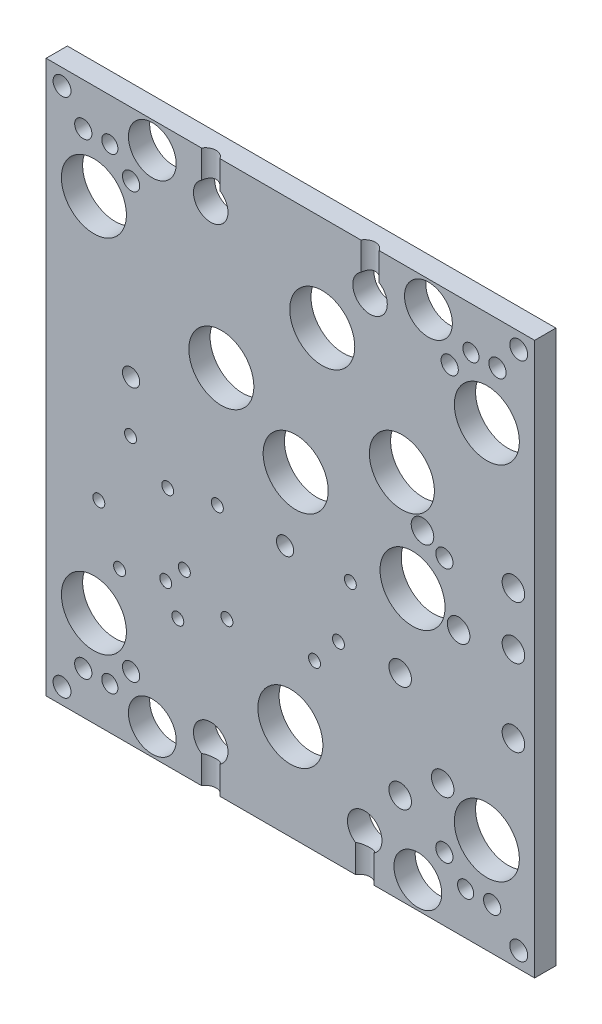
SolidWorks part; units mm, degrees
ref_plane "Front" through (0, 0, 0) normal (0, 0, 1) x (1, 0, 0)
ref_plane "Top" through (0, 0, 0) normal (0, 1, 0) x (1, 0, 0)
ref_plane "Right" through (0, 0, 0) normal (1, 0, 0) x (0, 0, -1)
sketch "Sketch1" plane through (0, 0, 0) normal (0, 0, 1) x (1, 0, 0)
  line L4 (-744.22, -180.975) -> (-452.12, -180.975)
  line L5 (-744.22, 149.225) -> (-744.22, -180.975)
  line L6 (-452.12, 149.225) -> (-744.22, 149.225)
  line L7 (-452.12, -180.975) -> (-452.12, 149.225)
  line L8 (-744.22, -180.975) -> (-452.12, -180.975)
  line L9 (-744.22, 149.225) -> (-744.22, -180.975)
  line L10 (-452.12, 149.225) -> (-744.22, 149.225)
  line L11 (-452.12, -180.975) -> (-452.12, 149.225)
  dimension "D1" = 0
extrude "Boss-Extrude1" add sketch "Sketch1" along normal blind 12.7 separate body
hole_wizard "Hole12" positions "Point_Sketch2" profile "Profil_Sketch2" hole size "Ø0.15" standard "ISO"
sketch "Point_Sketch2" plane through (-580.0679, -71.9155, 0) normal (0, 0, 1) x (-1, 0, 0)
  point P0 (3.6706, 10.6011)
  point P2 (-17.7441, -40.9069)
  point P4 (-10.6154, -6.4242)
sketch "Profil_Sketch2" plane through (-583.7385, -82.5166, 0) normal (1, 0, 0) x (0, 1, 0)
  line L0 (0, 0) -> (0, 12.7)
  line L1 (0, 12.7) -> (3.5687, 12.7)
  line L2 (3.5687, 12.7) -> (3.5687, 0)
  line L5 (3.5687, 0) -> (0, 0)
  line L11 (0, -6.35) -> (0, 107.95) construction
  dimension "Diameter" = 7.1374
  dimension "Thru Hole Depth" = 12.7
other "usin_DL090_.25-20x3-SHCS<2>"
hole_wizard "Hole13" positions "Point_Sketch3" profile "Profil_Sketch3" hole size "Ø0.15" standard "ISO"
sketch "Point_Sketch3" plane through (-638.1715, -20.035, 0) normal (0, 0, 1) x (-1, 0, 0)
  point P0 (3.6543, 10.9736)
  point P2 (23.3871, 54.2492)
sketch "Profil_Sketch3" plane through (-641.8258, -31.0086, 0) normal (1, 0, 0) x (0, 1, 0)
  line L0 (0, 0) -> (0, 12.7)
  line L1 (0, 12.7) -> (3.5687, 12.7)
  line L2 (3.5687, 12.7) -> (3.5687, 0)
  line L5 (3.5687, 0) -> (0, 0)
  line L11 (0, -6.35) -> (0, 107.95) construction
  dimension "Diameter" = 7.1374
  dimension "Thru Hole Depth" = 12.7
other "usin_DL090_.25-20x3-SHCS<3>"
hole_wizard "Hole14" positions "Point_Sketch4" profile "Profil_Sketch4" hole size "Ø0.15" standard "ISO"
sketch "Point_Sketch4" plane through (-669.0327, -75.0446, 0) normal (0, 0, 1) x (-1, 0, 0)
  point P0 (3.6543, 10.6011)
  point P2 (31.2649, 18.1837)
sketch "Profil_Sketch4" plane through (-672.6869, -85.6458, 0) normal (1, 0, 0) x (0, 1, 0)
  line L0 (0, 0) -> (0, 12.7)
  line L1 (0, 12.7) -> (3.5687, 12.7)
  line L2 (3.5687, 12.7) -> (3.5687, 0)
  line L5 (3.5687, 0) -> (0, 0)
  line L11 (0, -6.35) -> (0, 107.95) construction
  dimension "Diameter" = 7.1374
  dimension "Thru Hole Depth" = 12.7
other "usin_DL090_.25-20x3-SHCS<4>"
hole_wizard "Hole15" positions "Point_Sketch5" profile "Profil_Sketch5" hole size "Ø0.15" standard "ISO"
sketch "Point_Sketch5" plane through (-661.8264, -90.9577, 0) normal (0, 0, 1) x (-1, 0, 0)
  point P0 (3.6543, 10.6011)
  point P2 (-25.7119, -3.8452)
sketch "Profil_Sketch5" plane through (-665.4806, -101.5588, 0) normal (1, 0, 0) x (0, 1, 0)
  line L0 (0, 0) -> (0, 12.7)
  line L1 (0, 12.7) -> (3.5687, 12.7)
  line L2 (3.5687, 12.7) -> (3.5687, 0)
  line L5 (3.5687, 0) -> (0, 0)
  line L11 (0, -6.35) -> (0, 107.95) construction
  dimension "Diameter" = 7.1374
  dimension "Thru Hole Depth" = 12.7
other "usin_DL090_.25-20x3-SHCS<5>"
hole_wizard "Hole16" positions "Point_Sketch6" profile "Profil_Sketch6" hole size "Ø0.15" standard "ISO"
sketch "Point_Sketch6" plane through (-690.0832, -10.5362, 0) normal (0, 0, 1) x (-1, 0, 0)
  point P0 (3.6543, 10.6011)
  point P2 (22.6293, 53.408)
  point P4 (-18.5707, 26.4761)
sketch "Profil_Sketch6" plane through (-693.7375, -21.1374, 0) normal (1, 0, 0) x (0, 1, 0)
  line L0 (0, 0) -> (0, 12.7)
  line L1 (0, 12.7) -> (3.5687, 12.7)
  line L2 (3.5687, 12.7) -> (3.5687, 0)
  line L5 (3.5687, 0) -> (0, 0)
  line L11 (0, -6.35) -> (0, 107.95) construction
  dimension "Diameter" = 7.1374
  dimension "Thru Hole Depth" = 12.7
other "usin_DL090_.25-20x3-SHCS<6>"
hole_wizard "Hole17" positions "Point_Sketch7" profile "Profil_Sketch7" hole size "Ø0.15" standard "ISO"
sketch "Point_Sketch7" plane through (-527.9539, -6.8972, 12.7) normal (0, 0, -1) x (1, 0, 0)
  point P0 (47.2589, -98.9722)
  point P6 (-187.6911, -98.9722)
  point P8 (-187.6911, 116.9278)
  point P10 (-111.4911, -48.1722)
  point P12 (-3.5411, -48.1722)
  point P16 (-70.2161, 116.9278)
  point P18 (-67.0411, -16.4222)
  point P20 (-51.1661, -98.9722)
sketch "Profil_Sketch7" plane through (-480.695, 92.075, 12.7) normal (1, 0, 0) x (0, -1, 0)
  line L0 (0, 0) -> (0, 12.7)
  line L1 (0, 12.7) -> (19.4437, 12.7)
  line L2 (19.4437, 12.7) -> (19.4437, 0)
  line L5 (19.4437, 0) -> (0, 0)
  line L11 (0, -6.35) -> (0, 107.95) construction
  dimension "Diameter" = 38.8874
  dimension "Thru Hole Depth" = 12.7
other "usin_DL090_DADCO INCH U 0600.025 - 1500 psi<7>"
hole_wizard "Hole18" positions "Point_Sketch8" profile "Profil_Sketch8" hole size "Ø0.15" standard "ISO"
sketch "Point_Sketch8" plane through (-505.6157, -154.4989, 0) normal (0, 0, 1) x (-1, 0, 0)
  point P0 (16.3543, 10.6011)
  point P2 (10.0043, -287.8489)
  point P4 (175.1043, -287.8489)
  point P6 (175.1043, 10.6011)
sketch "Profil_Sketch8" plane through (-521.97, -165.1, 0) normal (1, 0, 0) x (0, 1, 0)
  line L0 (0, 0) -> (0, 12.7)
  line L1 (0, 12.7) -> (14.2875, 12.7)
  line L2 (14.2875, 12.7) -> (14.2875, 0)
  line L5 (14.2875, 0) -> (0, 0)
  line L11 (0, -6.35) -> (0, 107.95) construction
  dimension "Diameter" = 28.575
  dimension "Thru Hole Depth" = 12.7
other "usin_DL090<8>"
hole_wizard "Hole19" positions "Point_Sketch9" profile "Profil_Sketch9" hole size "Ø0.15" standard "ISO"
sketch "Point_Sketch9" plane through (-718.3407, 134.4261, 0) normal (0, 0, 1) x (-1, 0, 0)
  point P0 (3.6543, 10.6011)
  point P2 (-243.9957, 10.6011)
  point P4 (-240.8207, 290.0011)
  point P6 (3.6543, 290.0011)
  point P8 (-116.9957, 166.1761)
  point P10 (-212.2457, 124.9011)
  point P12 (-24.9207, 124.9011)
sketch "Profil_Sketch9" plane through (-721.995, 123.825, 0) normal (1, 0, 0) x (0, 1, 0)
  line L0 (0, 0) -> (0, 12.7)
  line L1 (0, 12.7) -> (5.1562, 12.7)
  line L2 (5.1562, 12.7) -> (5.1562, 0)
  line L5 (5.1562, 0) -> (0, 0)
  line L11 (0, -6.35) -> (0, 107.95) construction
  dimension "Diameter" = 10.3124
  dimension "Thru Hole Depth" = 12.7
other "usin_DL090_.375-16x2-SHCS<9>"
hole_wizard "Hole110" positions "Point_Sketch10" profile "Profil_Sketch10" hole size "Ø0.15" standard "ISO"
sketch "Point_Sketch10" plane through (-500.2243, -144.9739, 12.7) normal (0, 0, -1) x (1, 0, 0)
  point P0 (6.8293, 10.6011)
  point P2 (-205.8957, 10.6011)
  point P4 (-205.8957, -268.7989)
  point P6 (10.0043, -268.7989)
sketch "Profil_Sketch10" plane through (-493.395, -155.575, 12.7) normal (1, 0, 0) x (0, -1, 0)
  line L0 (0, 0) -> (0, 12.7)
  line L1 (0, 12.7) -> (4.826, 12.7)
  line L2 (4.826, 12.7) -> (4.826, 0)
  line L5 (4.826, 0) -> (0, 0)
  line L11 (0, -6.35) -> (0, 107.95) construction
  dimension "Diameter" = 9.652
  dimension "Thru Hole Depth" = 12.7
other "usin_DL090_.375 x 2.00 DOWEL PIN<10>"
hole_wizard "Hole111" positions "Point_Sketch11" profile "Profil_Sketch11" counterbore size "1/4" standard "ANSI Inch"
sketch "Point_Sketch11" plane through (-747.5641, 140.635, 12.7) normal (0, 0, -1) x (1, 0, 0)
  point P0 (12.8691, 0.935)
  point P2 (285.9191, 0.935)
  point P4 (285.9191, 312.085)
  point P6 (12.8691, 312.085)
sketch "Profil_Sketch11" plane through (-734.695, 139.7, 12.7) normal (1, 0, 0) x (0, -1, 0)
  line L0 (0, 0) -> (0, 12.7)
  line L1 (0, 12.7) -> (3.5687, 12.7)
  line L3 (3.5687, 12.7) -> (3.5687, 7.874)
  line L4 (3.5687, 7.874) -> (5.3594, 7.874)
  line L5 (5.3594, 7.874) -> (5.3594, 0)
  line L7 (5.3594, 0) -> (0, 0)
  line L11 (0, -6.35) -> (0, 107.95) construction
  dimension "Diameter" = 7.1374
  dimension "Thru Hole Depth" = 12.7
  dimension "L1" = 7.874
other "usin_LS160_.25-20x.625-SHCS<1>"
hole_wizard "Hole112" positions "Point_Sketch12" profile "Profil_Sketch12" hole size "Ø0.15" standard "ISO"
sketch "Point_Sketch12" plane through (-655.7993, 134.4261, 12.7) normal (0, 0, -1) x (1, 0, 0)
  point P0 (10.0043, 10.6011)
  point P2 (105.2543, 10.6011)
  point P4 (102.0793, 290.0011)
  point P6 (10.0043, 290.0011)
sketch "Profil_Sketch12" plane through (-645.795, 123.825, 12.7) normal (1, 0, 0) x (0, -1, 0)
  line L0 (0, 0) -> (0, 12.7)
  line L1 (0, 12.7) -> (10.3187, 12.7)
  line L2 (10.3187, 12.7) -> (10.3187, 0)
  line L5 (10.3187, 0) -> (0, 0)
  line L11 (0, -6.35) -> (0, 107.95) construction
  dimension "Diameter" = 20.6375
  dimension "Thru Hole Depth" = 12.7
other "usin_DL090<11>"
hole_wizard "Hole113" positions "Point_Sketch13" profile "Profil_Sketch13" hole size "Ø0.15" standard "ISO"
sketch "Point_Sketch13" plane through (-689.7657, -132.2739, 0) normal (0, 0, 1) x (-1, 0, 0)
  point P0 (3.6543, 10.6011)
  point P2 (-183.6707, 10.6011)
  point P4 (-186.8457, -243.3989)
  point P6 (3.6543, -243.3989)
sketch "Profil_Sketch13" plane through (-693.42, -142.875, 0) normal (1, 0, 0) x (0, 1, 0)
  line L0 (0, 0) -> (0, 12.7)
  line L1 (0, 12.7) -> (5.1594, 12.7)
  line L2 (5.1594, 12.7) -> (5.1594, 0)
  line L5 (5.1594, 0) -> (0, 0)
  line L11 (0, -6.35) -> (0, 107.95) construction
  dimension "Diameter" = 10.3187
  dimension "Thru Hole Depth" = 12.7
other "usin_DL090<12>"
sketch "Sketch4" plane through (0, -180.975, 0) normal (0, -1, 0) x (1, 0, 0)
  line L4 (-744.22, 12.7) -> (-452.12, 12.7) construction
  line L5 (-645.795, 0) -> (-645.795, 12.7) construction
  line L6 (-553.72, 0) -> (-553.72, 12.7) construction
  circle A0 centre (-645.795, 15.875) radius 6.35
  circle A1 centre (-553.72, 15.875) radius 6.35
  dimension "D1" = 12.7
  dimension "d2" = 3.175
extrude "Cut-Extrude1" cut sketch "Sketch4" against normal up to next
sketch "Sketch5" plane through (0, 149.225, 0) normal (0, 1, 0) x (1, 0, 0)
  line L0 (-452.12, -12.7) -> (-744.22, -12.7) construction
  line L1 (-550.545, 0) -> (-550.545, -12.7) construction
  line L2 (-645.795, 0) -> (-645.795, -12.7) construction
  circle A0 centre (-550.545, -15.875) radius 6.35
  circle A1 centre (-645.795, -15.875) radius 6.35
  dimension "D2" = 12.7
  dimension "D1" = 3.175
extrude "Cut-Extrude2" cut sketch "Sketch5" against normal up to next
hole_wizard "Hole1" positions "Point_Sketch" profile "Profil_Sketch" hole size "Ø0.15" standard "ISO"
sketch "Point_Sketch" plane through (-528.7993, -5.2739, 12.7) normal (0, 0, -1) x (1, 0, 0)
  point P0 (3.6543, 10.6011)
  point P2 (48.1043, 118.5511)
sketch "Profil_Sketch" plane through (-525.145, -15.875, 12.7) normal (1, 0, 0) x (0, -1, 0)
  line L0 (0, 0) -> (0, 12.7)
  line L1 (0, 12.7) -> (19.4437, 12.7)
  line L2 (19.4437, 12.7) -> (19.4437, 0)
  line L5 (19.4437, 0) -> (0, 0)
  line L11 (0, -6.35) -> (0, 107.95) construction
  dimension "Diameter" = 38.8874
  dimension "Thru Hole Depth" = 12.7
other "usin_DL090_DADCO INCH U 0600.025 - 1500 psi<13>"
hole_wizard "Hole114" positions "Point_Sketch14" profile "Profil_Sketch14" hole size "Ø0.15" standard "ISO"
sketch "Point_Sketch14" plane through (-536.1653, -116.0814, 12.7) normal (0, 0, -1) x (1, 0, 0)
  point P0 (3.6543, 10.6011)
  point P2 (29.0543, -8.4489)
  point P4 (71.3453, -130.6864)
  point P6 (16.9893, -133.2264)
  point P8 (3.6543, -52.8989)
  point P10 (38.5793, -92.5864)
  point P12 (71.3453, -52.8989)
  point P14 (71.3453, -98.9364)
sketch "Profil_Sketch14" plane through (-532.511, -126.6825, 12.7) normal (1, 0, 0) x (0, -1, 0)
  line L0 (0, 0) -> (0, 12.7)
  line L1 (0, 12.7) -> (6.7469, 12.7)
  line L2 (6.7469, 12.7) -> (6.7469, 0)
  line L5 (6.7469, 0) -> (0, 0)
  line L11 (0, -6.35) -> (0, 107.95) construction
  dimension "Diameter" = 13.4937
  dimension "Thru Hole Depth" = 12.7
other "usin_DL090_.3125-18x1-SHCS<14>"
